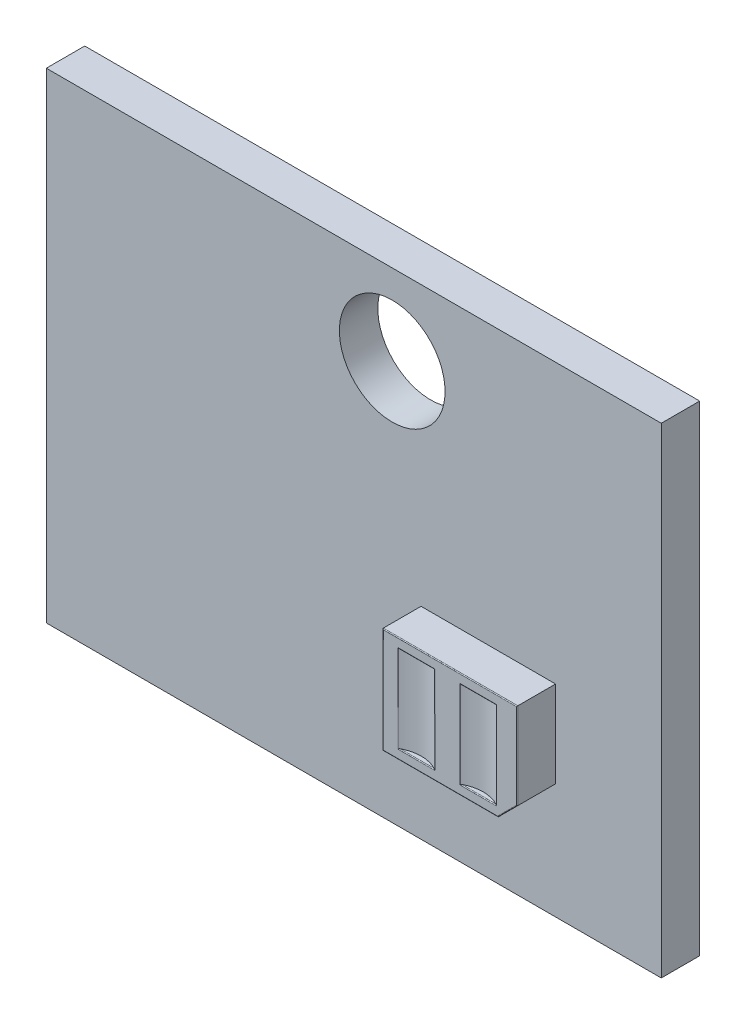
SolidWorks part; units mm, degrees
ref_plane "Face" through (0, 0, 0) normal (0, 0, 1) x (1, 0, 0)
ref_plane "Dessus" through (0, 0, 0) normal (0, 1, 0) x (1, 0, 0)
ref_plane "Droite" through (0, 0, 0) normal (1, 0, 0) x (0, 0, -1)
sketch "Esquisse1" plane through (0, 0, 0) normal (0, 0, 1) x (1, 0, 0)
  line L1 (-8.25, 6.25) -> (7.75, 6.25)
  line L2 (-8.25, 6.25) -> (-8.25, -6.25)
  line L3 (-8.25, -6.25) -> (7.75, -6.25)
  line L4 (7.75, 6.25) -> (7.75, -6.25)
  circle A0 centre (0.75, 4.15) radius 1.375
  dimension "D5" = 2.75
  dimension "D1" = 6.25
  dimension "D2" = 12.5
  dimension "D3" = 8.25
  dimension "D4" = 16
  dimension "D6" = 2.1
  dimension "D7" = 7
extrude "Extrusion1" add sketch "Esquisse1" along normal blind 1
sketch "Esquisse3" plane through (0, 0, 0) normal (0, 0, 1) x (1, 0, 0)
  line L0 (1.5, -1) -> (5, -1)
  line L1 (5, -1) -> (5, -3.25)
  line L2 (5, -3.25) -> (4.5, -3.75)
  line L3 (4.5, -3.75) -> (1.5, -3.75)
  line L4 (1.5, -3.75) -> (1.5, -1)
  line L5 (-8.25, -6.25) -> (7.75, -6.25) construction
  line L6 (7.75, -6.25) -> (7.75, 6.25) construction
  dimension "D1" = 2.5
  dimension "D2" = 2.75
  dimension "D3" = 3.5
  dimension "D4" = 2.75
  dimension "D5" = 45
  dimension "D6" = 0.5
extrude "Extrusion2" add sketch "Esquisse3" along normal blind 2
ref_plane "Plan1" through (0, -3.5, 0) normal (0, -1, 0) x (1, 0, 0)
sketch "Esquisse4" plane through (0, -3.5, 0) normal (0, -1, 0) x (1, 0, 0)
  line L0 (3.1846, 2.8941) -> (3.1846, -0.6438) construction
  line L1 (1.5, 2) -> (4.5, 2) construction
  line L2 (1.9055, 2) -> (2.8557, 2)
  line L3 (4.4638, 2) -> (3.5136, 2)
  line L4 (4.5, 2) -> (5, 2) construction
  arc A0 (1.9055, 2) -> (2.8557, 2) centre (2.3806, 2.8243) ccw
  arc A1 (4.4638, 2) -> (3.5136, 2) centre (3.9887, 2.8243) cw
extrude "Enlèv. mat.-Extru.1" cut sketch "Esquisse4" against normal blind 2.25
fillet "Congé1" radius 0.02
sketch "Esquisse5"
